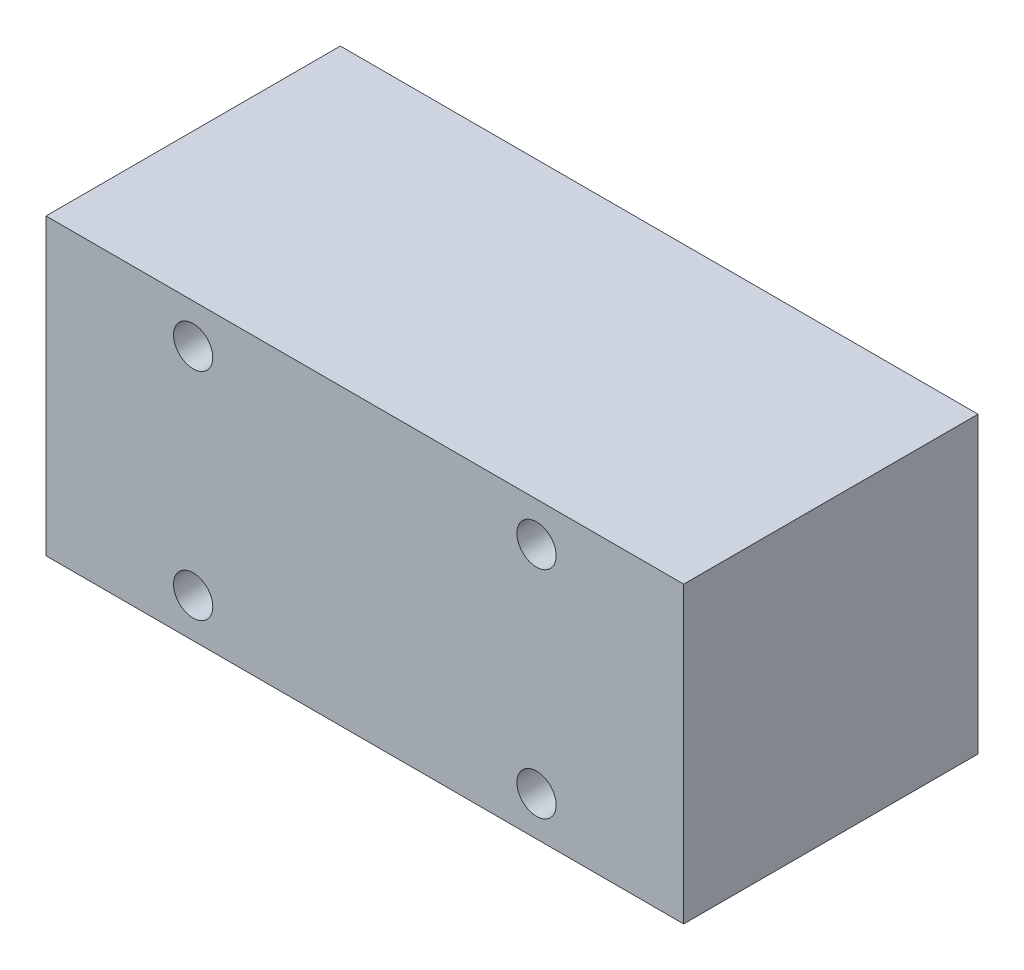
SolidWorks part; units mm, degrees
ref_plane "Plan de face" through (0, 0, 0) normal (0, 0, 1) x (1, 0, 0)
ref_plane "Plan de dessus" through (0, 0, 0) normal (0, 1, 0) x (1, 0, 0)
ref_plane "Plan de droite" through (0, 0, 0) normal (1, 0, 0) x (0, 0, -1)
sketch "Esquisse1" plane through (0, 0, 0) normal (0, 0, 1) x (1, 0, 0)
  line L1 (0, 0) -> (-65, 0)
  line L2 (0, 0) -> (0, 30)
  line L3 (0, 30) -> (-65, 30)
  line L4 (-65, 0) -> (-65, 30)
  dimension "D1" = 65
  dimension "D2" = 30
extrude "Extrusion1" add sketch "Esquisse1" along normal blind 30
sketch "Esquisse2" plane through (0, 0, 30) normal (0, 0, 1) x (1, 0, 0)
  line L0 (-65, 30) -> (-65, 0) construction
  line L1 (-65, 0) -> (0, 0) construction
  line L2 (0, 30) -> (-65, 30) construction
  circle A0 centre (-50, 26) radius 2
  circle A1 centre (-50, 4) radius 2
  circle A2 centre (-15, 4) radius 2
  circle A3 centre (-15, 26) radius 2
  dimension "D1" = 4
  dimension "D2" = 4
  dimension "D5" = 4
  dimension "D6" = 4
  dimension "D3" = 22
  dimension "D4" = 15
  dimension "D7" = 35
  dimension "D8" = 35
  dimension "D9" = 4
  dimension "D10" = 4
  dimension "D11" = 4
  dimension "D12" = 4
extrude "Extrusion2" cut sketch "Esquisse2" against normal blind 10
sketch "Esquisse3" plane through (-65, 0, 0) normal (-1, 0, 0) x (0, 0, 1)
  line L0 (0, 30) -> (30, 0) construction
  line L1 (30, 0) -> (0, 0) construction
  line L2 (30, 30) -> (30, 0) construction
  line L3 (0, 0) -> (30, 30) construction
  circle A0 centre (15, 15) radius 3
  point P10 (15, 15)
  dimension "D1" = 6
extrude "Extrusion3" add sketch "Esquisse3" along normal blind 10
